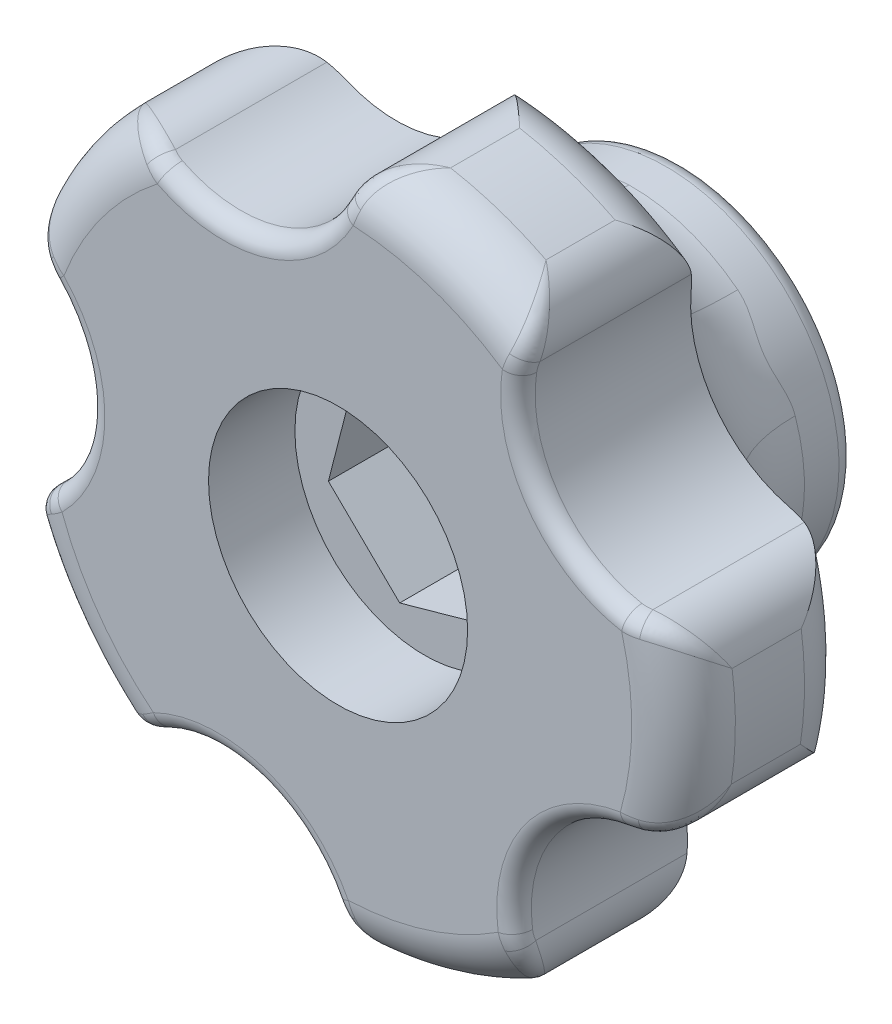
SolidWorks part; units mm, degrees
ref_plane "Ebene vorne" through (0, 0, 0) normal (1, 0, 0) x (0, 1, 0)
ref_plane "Ebene oben" through (0, 0, 0) normal (0, 0, 1) x (0, 1, 0)
ref_plane "Ebene rechts" through (0, 0, 0) normal (0, 1, 0) x (-1, 0, 0)
sketch "Skizze1" plane through (0, 0, 0) normal (0, 0, 1) x (0, 1, 0)
  circle A0 centre (0, 0) radius 20
  dimension "D1" = 40
extrude "Aufsatz-Linear austragen1" add sketch "Skizze1" along normal blind 10
sketch "Skizze2" plane through (0, 0, 10) normal (0, 0, 1) x (1, 0, 0)
  circle A0 centre (-21.9992, 0.1874) radius 7.5
  circle A1 centre (-6.6199, 20.9804) radius 7.5
  circle A7 centre (17.9079, 12.7792) radius 7.5
  circle A8 centre (17.6876, -13.0824) radius 7.5
  circle A9 centre (-6.9764, -20.8646) radius 7.5
  point P13 (0, 0)
  dimension "D1" = 15
  dimension "D2" = 22
extrude "Schnitt-Linear austragen1" cut sketch "Skizze2" against normal through all
fillet "Verrundung4" radius 3 20 edges at (11.3698, 16.4538, 5) (19.2568, 5.4015, 5) (6.3422, 18.9678, 10) (-12.1351, 15.8978, 5) (0.8136, 19.9834, 5) (6.3422, 18.9678, 0) (19.162, -5.7288, 5) (11.0878, -16.6451, 5) (19.9993, -0.1704, 10) (19.9993, -0.1704, 0) (0.473, -19.9944, 5) (-12.4042, -15.6888, 5) (6.0181, -19.0731, 10) (6.0181, -19.0731, 0) (-16.2799, -11.6174, 0) (-18.8697, -6.6284, 5) (-18.754, 6.949, 5) (-16.2799, -11.6174, 10) (-16.0796, 11.8931, 10) (-16.0796, 11.8931, 0)
sketch "Skizze3" plane through (0, 0, 0) normal (0, 0, -1) x (1, 0, 0)
  circle A0 centre (0, 0) radius 10
  dimension "D1" = 20
extrude "Aufsatz-Linear austragen2" add sketch "Skizze3" along normal blind 10
sketch "Skizze4" plane through (0, 0, 10) normal (0, 0, 1) x (1, 0, 0)
  circle A0 centre (0, 0) radius 3.125
  dimension "D1" = 6.25
extrude "Schnitt-Linear austragen2" cut sketch "Skizze4" against normal through all
sketch "Skizze5" plane through (0, 0, 10) normal (0, 0, 1) x (1, 0, 0)
  line L1 (4.127, -4.0374) -> (5.56, 1.5554)
  line L2 (5.56, 1.5554) -> (1.433, 5.5928)
  line L3 (1.433, 5.5928) -> (-4.127, 4.0374)
  line L4 (-4.127, 4.0374) -> (-5.56, -1.5554)
  line L5 (-5.56, -1.5554) -> (-1.433, -5.5928)
  line L6 (-1.433, -5.5928) -> (4.127, -4.0374)
  circle A0 centre (0, 0) radius 5 construction
  dimension "D1" = 10
extrude "Schnitt-Linear austragen3" cut sketch "Skizze5" against normal blind 10
sketch "Skizze6" plane through (0, 0, 10) normal (0, 0, 1) x (1, 0, 0)
  circle A0 centre (0, 0) radius 7.5
  dimension "D1" = 15
extrude "Schnitt-Linear austragen4" cut sketch "Skizze6" against normal blind 5
fillet "Verrundung5" radius 7 1 edges at (10, 0, 0)
fillet "Verrundung6" radius 1 1 edges at (-10, 0, -10)
fillet "Verrundung7" radius 1 25 edges at (-18.0785, -7.2044, 8.7155) (-17.9531, 7.5113, 8.7155) (1.2652, -19.4199, 8.7155) (-12.6915, -14.7533, 8.7155) (18.8604, -4.7978, 8.7155) (10.1093, -16.6294, 8.7155) (10.3912, 16.4547, 8.7155) (18.9394, 4.4758, 8.7155) (-12.4383, 14.9674, 8.7155) (1.5959, 19.3956, 8.7155) (-14.4995, 0.1235, 10) (-4.5981, -13.7516, 10) (11.6577, -8.6225, 10) (11.8029, 8.4226, 10) (-4.3631, 13.828, 10)
